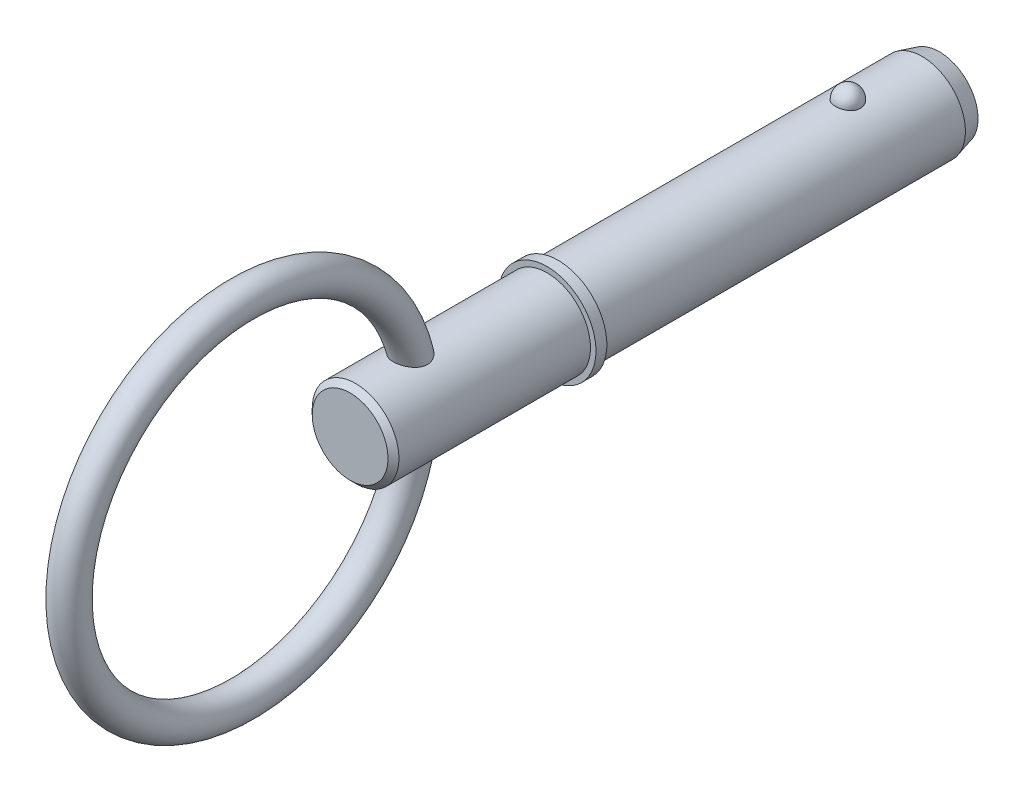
SolidWorks part; units mm, degrees
ref_plane "Front Plane" through (0, 0, 0) normal (0, 0, 1) x (1, 0, 0)
ref_plane "Top Plane" through (0, 0, 0) normal (0, 1, 0) x (1, 0, 0)
ref_plane "Right Plane" through (0, 0, 0) normal (1, 0, 0) x (0, 0, -1)
sketch "Sketch2" plane through (0, 0, 0) normal (0, 0, 1) x (1, 0, 0)
  circle A0 centre (0, 0) radius 3.97
  point P3 (0, 3.97)
  dimension "D1" = 7.94
extrude "Boss-Extrude1" add sketch "Sketch2" along normal blind 25.4
sketch "Sketch3" plane through (0, 0, 0) normal (0, 0, -1) x (-1, 0, 0)
  circle A0 centre (0, 0) radius 3.97
  dimension "D1" = 7.94
extrude "Boss-Extrude2" add sketch "Sketch3" along normal blind 9.53
chamfer "Chamfer1" distance 1.586 angle 15 1 edges at (-3.97, 0, -9.53)
sketch "Sketch18" plane through (0, 0, 0) normal (1, 0, 0) x (0, 0, -1)
  line L0 (7.944, 3.97) -> (-25.4, 3.97) construction
  line L1 (1.15, 5.12) -> (1.15, 2.82)
  line L2 (-25.4, -3.97) -> (7.944, -3.97) construction
  arc A0 (1.15, 5.12) -> (1.15, 2.82) centre (1.15, 3.97) ccw
  point P4 (0, 3.97)
  dimension "D1" = 9.09
revolve "Revolve1" add sketch "Sketch18" angle 360 about L1
sketch "Sketch19" plane through (0, 0, 0) normal (1, 0, 0) x (0, 0, -1)
  line L0 (-33.7288, 0) -> (-46.4542, 0) construction
sketch "Sketch20" plane through (0, 0, 0) normal (1, 0, 0) x (0, 0, -1)
  line L0 (-25.4, 0) -> (-25.4, 4.47)
  line L1 (-25.4, 3.97) -> (-25.4, -3.97) construction
  line L2 (-25.4, 4.47) -> (-26.4, 4.47)
  line L3 (-26.4, 4.47) -> (-26.4, 0)
  line L4 (-33.7288, 0) -> (-46.4542, 0) construction
  line L5 (-26.4, 0) -> (-25.4, 0)
  dimension "D1" = 4.47
  dimension "D2" = 1
revolve "Revolve2" add sketch "Sketch20" angle 360 about L0
sketch "Sketch21" plane through (0, 0, 25.4) normal (0, 0, -1) x (-1, 0, 0)
  circle A0 centre (0, 0) radius 3.97
  dimension "D1" = 7.94
extrude "Boss-Extrude3" add sketch "Sketch21" against normal blind 19.05
chamfer "Chamfer2" distance 0.5 angle 45 1 edges at (-3.97, 0, 44.45)
sketch "Sketch23" plane through (0, 0, 0) normal (1, 0, 0) x (0, 0, -1)
  line L0 (-44.45, 3.47) -> (-44.45, -3.47) construction
  circle A0 centre (-54.325, 0) radius 15.875
  point P2 (-38.45, 0)
  dimension "D1" = 31.75
  dimension "D2" = 6
sketch "Sketch24" plane through (0, 0, 0) normal (0, 1, 0) x (1, 0, 0)
  circle A0 centre (0, -38.45) radius 1.5
  dimension "D1" = 3
sweep "Sweep1" add profiles "Sketch24" path "Sketch23"
